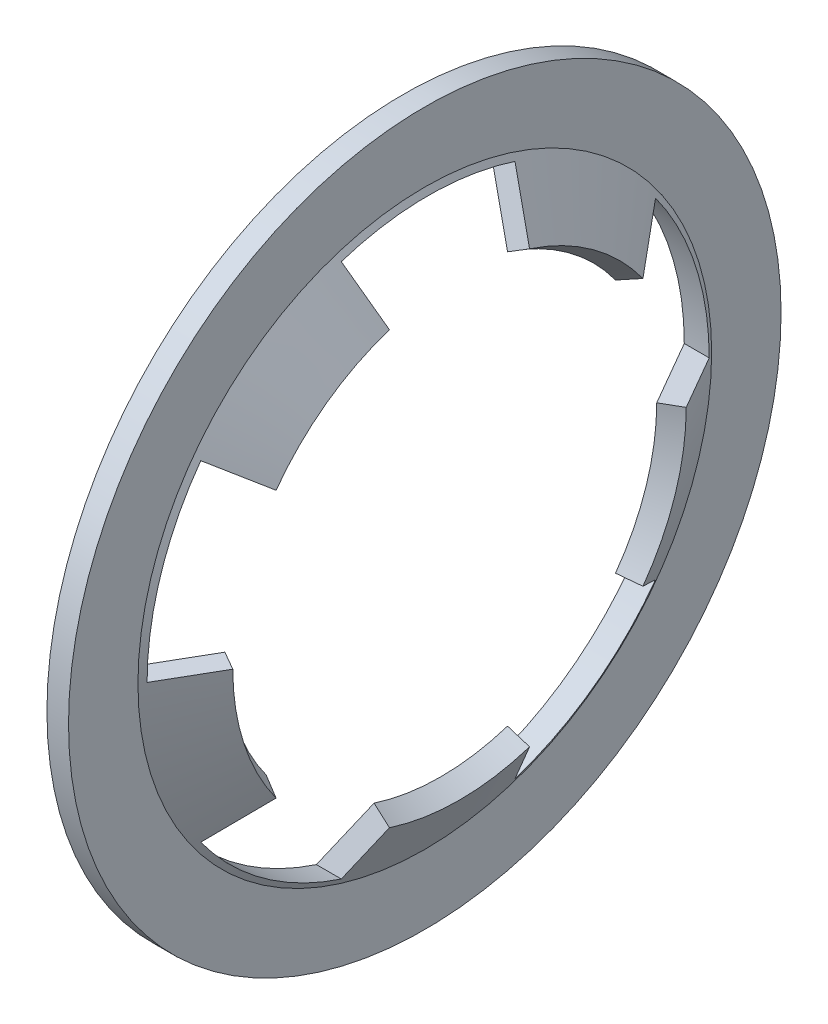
SolidWorks part; units mm, degrees
revolve "Base-Révol.-Mince" add sketch "Esquisse1" angle 360 about L9
sketch "Esquisse1" plane through (0, 0, 0) normal (0, 0, 1) x (1, 0, 0)
  line L0 (0, 4) -> (0, -4) construction
  line L1 (0, 6.6) -> (0, -6.6) construction
  line L3 (0, 5.2067) -> (0, 6.6)
  line L4 (0, 5.2067) -> (0.6967, 4)
  line L9 (0, 0) -> (1, 0) construction
ref_plane "Plan1" through (0, 0, 0) normal (0, 0, 1) x (1, 0, 0)
ref_plane "Plan2" through (0, 0, 0) normal (0, 1, 0) x (1, 0, 0)
ref_plane "Plan3" through (0, 0, 0) normal (1, 0, 0) x (0, 0, -1)
sketch "Esquisse2" plane through (0, 0, 0) normal (1, 0, 0) x (0, 0, -1)
  line L0 (-3.2361, 2.3511) -> (-4.2123, 3.0604)
  line L1 (-4, 0) -> (-5.2067, 0)
  line L4 (0, 0) -> (-9.7745, 3.1759) construction
  line L5 (0, 0) -> (0, 9.3593) construction
  arc A0 (-3.2361, 2.3511) -> (-4, 0) centre (0, 0) ccw
  circle A3 centre (0, 0) radius 4 construction
  arc A7 (-4.2123, 3.0604) -> (-5.2067, 0) centre (0, 0) ccw
  circle A8 centre (0, 0) radius 5.2067 construction
extrude "Enlèv. mat.-Extru.2" cut sketch "Esquisse2" along normal through all
pattern_circular "Répétition circulaire1" count 5 over 360 about axis through (0, 0, 0) along (1, 0, 0)
equation "\"Rext@Esquisse1\" = \"Diamètre extérieur@Esquisse1\"/2"
equation "\"Rn@Esquisse1\" = \"Diamètre nominal@Esquisse1\"/2"
equation "\"D1@Esquisse2\" = 360/\"Nbr de dents@Répétition circulaire1\""
equation "\"D2@Esquisse2\" = 360/(\"Nbr de dents@Répétition circulaire1\"*4)"
